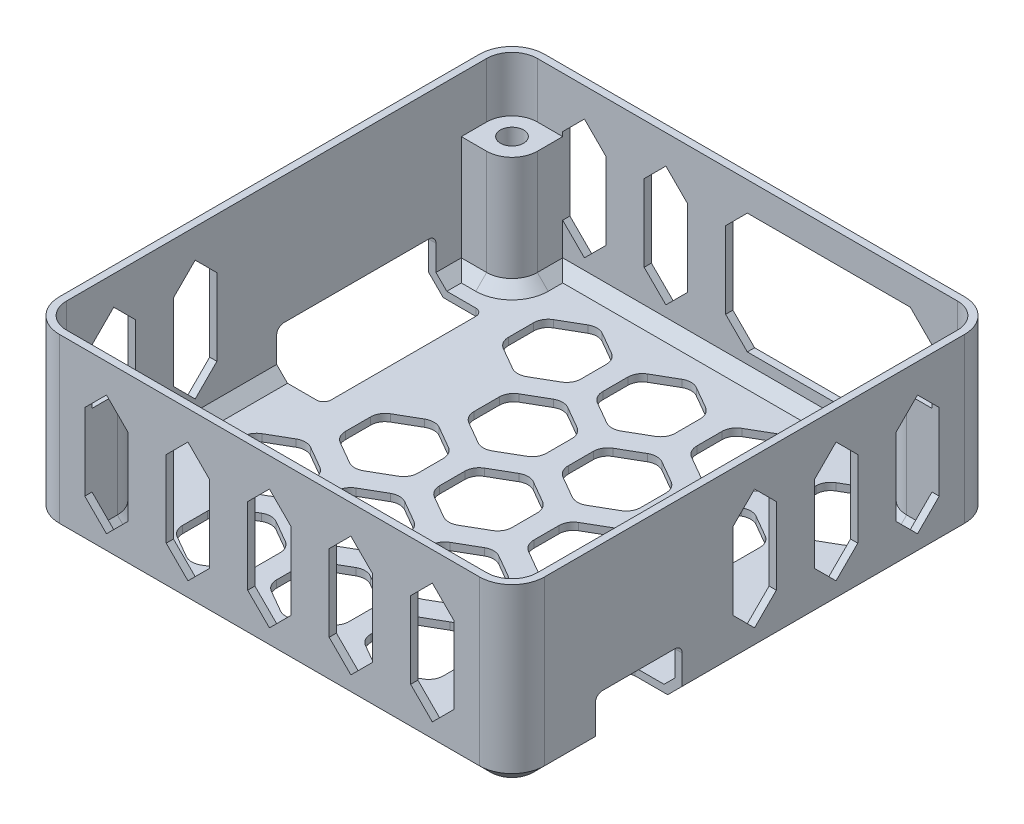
SolidWorks part; units mm, degrees
ref_plane "前视基准面" through (0, 0, 0) normal (0, 0, 1) x (1, 0, 0)
ref_plane "上视基准面" through (0, 0, 0) normal (0, 1, 0) x (1, 0, 0)
ref_plane "右视基准面" through (0, 0, 0) normal (1, 0, 0) x (0, 0, -1)
other "Configuration Table"
sketch "草图1" plane through (0, 0, 0) normal (0, 1, 0) x (1, 0, 0)
  line L0 (-29, 29) -> (29, 29) construction
  line L1 (-29, 33.5) -> (29, 33.5)
  line L2 (-33.5, 29) -> (-33.5, -29)
  line L3 (-29, -33.5) -> (29, -33.5)
  line L4 (33.5, 29) -> (33.5, -29)
  line L5 (-29, 29) -> (-29, -29) construction
  circle A0 centre (-29, 29) radius 1.6
  circle A1 centre (29, 29) radius 1.6
  circle A2 centre (29, -29) radius 1.6
  circle A3 centre (-29, -29) radius 1.6
  arc A4 (-33.5, -29) -> (-29, -33.5) centre (-29, -29) ccw
  arc A5 (29, -33.5) -> (33.5, -29) centre (29, -29) ccw
  arc A6 (29, 33.5) -> (33.5, 29) centre (29, 29) cw
  arc A7 (-29, 33.5) -> (-33.5, 29) centre (-29, 29) ccw
  dimension "D6" = 3.2
  dimension "D13" = 4.5
  dimension "D3" = 90
  dimension "D4" = 58
  dimension "D5" = 58
  dimension "D7" = 29
  dimension "D8" = 29
  dimension "D9" = 4.5
  dimension "D10" = 4.5
  dimension "D11" = 4.5
  dimension "D12" = 4.5
  dimension "D1" = 2
  dimension "D2" = 2
extrude "凸台-拉伸1" add sketch "草图1" along normal blind 1
sketch "草图2" plane through (0, 1, 0) normal (0, 1, 0) x (1, 0, 0)
  line L0 (29, 33.5) -> (-29, 33.5) construction
  line L1 (-33.5, 29) -> (-33.5, -29) construction
  line L2 (-29, -33.5) -> (29, -33.5) construction
  line L3 (33.5, -29) -> (33.5, 29) construction
  line L4 (29, 33.5) -> (-29, 33.5)
  line L5 (-33.5, 29) -> (-33.5, -29)
  line L6 (-29, -33.5) -> (29, -33.5)
  line L7 (33.5, -29) -> (33.5, 29)
  line L8 (-29, -32.5) -> (29, -32.5)
  line L9 (32.5, -29) -> (32.5, 29)
  line L10 (29, 32.5) -> (-29, 32.5)
  line L11 (-32.5, 29) -> (-32.5, -29)
  arc A0 (-33.5, -29) -> (-29, -33.5) centre (-29, -29) ccw construction
  arc A1 (29, -33.5) -> (33.5, -29) centre (29, -29) ccw construction
  arc A2 (33.5, 29) -> (29, 33.5) centre (29, 29) ccw construction
  arc A3 (-29, 33.5) -> (-33.5, 29) centre (-29, 29) ccw construction
  arc A4 (-33.5, -29) -> (-29, -33.5) centre (-29, -29) ccw
  arc A5 (29, -33.5) -> (33.5, -29) centre (29, -29) ccw
  arc A6 (33.5, 29) -> (29, 33.5) centre (29, 29) ccw
  arc A7 (-29, 33.5) -> (-33.5, 29) centre (-29, 29) ccw
  arc A8 (-32.5, -29) -> (-29, -32.5) centre (-29, -29) ccw
  arc A9 (29, -32.5) -> (32.5, -29) centre (29, -29) ccw
  arc A10 (32.5, 29) -> (29, 32.5) centre (29, 29) ccw
  arc A11 (-29, 32.5) -> (-32.5, 29) centre (-29, 29) ccw
  circle A12 centre (-29, -29) radius 1.6 construction
  circle A13 centre (29, -29) radius 1.6 construction
  circle A14 centre (29, 29) radius 1.6 construction
  circle A15 centre (-29, 29) radius 1.6 construction
  circle A16 centre (-29, -29) radius 1.6
  circle A17 centre (29, -29) radius 1.6
  circle A18 centre (29, 29) radius 1.6
  circle A19 centre (-29, 29) radius 1.6
  dimension "D1" = 1
extrude "凸台-拉伸2" add sketch "草图2" along normal blind 23.6 contours A11 L10 A10 L9 A9 L8 A8 L11 M26 M19 M20 M21 M22 M23 M24 M25
sketch "草图3" plane through (0, 1, 0) normal (0, 1, 0) x (1, 0, 0)
  line L0 (-29, 32.5) -> (-25.5, 32.5)
  line L1 (29, 32.5) -> (-29, 32.5) construction
  line L2 (-25.5, 32.5) -> (-25.5, 29)
  line L3 (-29, 25.5) -> (-32.5, 25.5)
  line L4 (-32.5, 29) -> (-32.5, -29) construction
  line L5 (-32.5, 25.5) -> (-32.5, 29)
  line L6 (32.5, 29) -> (32.5, 25.5)
  line L7 (32.5, 25.5) -> (29, 25.5)
  line L8 (25.5, 29) -> (25.5, 32.5)
  line L9 (25.5, 32.5) -> (29, 32.5)
  line L10 (29, -32.5) -> (25.5, -32.5)
  line L11 (25.5, -32.5) -> (25.5, -29)
  line L12 (29, -25.5) -> (32.5, -25.5)
  line L13 (32.5, -25.5) -> (32.5, -29)
  line L14 (-32.5, -29) -> (-32.5, -25.5)
  line L15 (-32.5, -25.5) -> (-29, -25.5)
  line L16 (-25.5, -29) -> (-25.5, -32.5)
  line L17 (-25.5, -32.5) -> (-29, -32.5)
  arc A3 (-29, 32.5) -> (-32.5, 29) centre (-29, 29) ccw construction
  circle A7 centre (-29, 29) radius 1.6 construction
  arc A8 (32.5, 29) -> (29, 32.5) centre (29, 29) ccw
  circle A9 centre (29, 29) radius 1.6
  arc A10 (25.5, 29) -> (29, 25.5) centre (29, 29) ccw
  arc A11 (-29, 32.5) -> (-32.5, 29) centre (-29, 29) ccw
  circle A15 centre (-29, 29) radius 1.6
  arc A16 (-29, 25.5) -> (-25.5, 29) centre (-29, 29) ccw
  arc A17 (29, -32.5) -> (32.5, -29) centre (29, -29) ccw
  circle A18 centre (29, -29) radius 1.6
  arc A19 (29, -25.5) -> (25.5, -29) centre (29, -29) ccw
  arc A20 (-32.5, -29) -> (-29, -32.5) centre (-29, -29) ccw
  circle A21 centre (-29, -29) radius 1.6
  arc A22 (-25.5, -29) -> (-29, -25.5) centre (-29, -29) ccw
  point P0 (-21.1789, -28.4706)
  point P40 (0, 0)
  dimension "D1" = 3.5
  dimension "D2" = 4
extrude "凸台-拉伸3" add sketch "草图3" along normal blind 16
sketch "草图5" plane through (0, 0, -33.5) normal (0, 0, 1) x (1, 0, 0)
  line L0 (-22.5, 20.6) -> (-25.5, 17.6)
  line L1 (-25.5, 17.6) -> (-25.5, 7)
  line L2 (-25.5, 7) -> (-22.5, 4)
  line L3 (-22.5, 4) -> (-19.5, 7)
  line L4 (-19.5, 7) -> (-19.5, 17.6)
  line L5 (-19.5, 17.6) -> (-22.5, 20.6)
  line L6 (-8.25, 17.6) -> (-11.25, 20.6)
  line L7 (-11.25, 20.6) -> (-14.25, 17.6)
  line L8 (-14.25, 17.6) -> (-14.25, 7)
  line L9 (-14.25, 7) -> (-11.25, 4)
  line L10 (-11.25, 4) -> (-8.25, 7)
  line L11 (-8.25, 7) -> (-8.25, 17.6)
  line L12 (3, 17.6) -> (0, 20.6)
  line L13 (0, 20.6) -> (-3, 17.6)
  line L14 (-3, 17.6) -> (-3, 7)
  line L15 (-3, 7) -> (0, 4)
  line L16 (0, 4) -> (3, 7)
  line L17 (3, 7) -> (3, 17.6)
  line L18 (14.25, 17.6) -> (11.25, 20.6)
  line L19 (11.25, 20.6) -> (8.25, 17.6)
  line L20 (8.25, 17.6) -> (8.25, 7)
  line L21 (8.25, 7) -> (11.25, 4)
  line L22 (11.25, 4) -> (14.25, 7)
  line L23 (14.25, 7) -> (14.25, 17.6)
  line L24 (25.5, 17.6) -> (22.5, 20.6)
  line L25 (22.5, 20.6) -> (19.5, 17.6)
  line L26 (19.5, 17.6) -> (19.5, 7)
  line L27 (19.5, 7) -> (22.5, 4)
  line L28 (22.5, 4) -> (25.5, 7)
  line L29 (25.5, 7) -> (25.5, 17.6)
  line L30 (-19.5, 17.6) -> (-8.25, 17.6) construction
  line L35 (-29, 24.6) -> (29, 24.6) construction
  line L36 (-29, 0) -> (29, 0) construction
  line L37 (-29, 24.6) -> (-29, 0) construction
  line L38 (29, 24.6) -> (29, 0) construction
  dimension "D1" = 6
  dimension "D2" = 4
  dimension "D4" = 4
  dimension "D5" = 3.5
  dimension "D6" = 3.5
  dimension "D3" = 5
extrude "切除-拉伸2" cut sketch "草图5" along normal through all
sketch "草图6" plane through (0, 0, 0) normal (0, -1, 0) x (1, 0, 0)
  line L1 (-33.5, 0) -> (-26, 0)
  line L2 (-33.5, 0) -> (-33.5, -22)
  line L3 (-33.5, -22) -> (-26, -22)
  line L4 (-26, 0) -> (-26, -22)
  line L5 (33.5, 22) -> (26, 22)
  line L6 (33.5, 22) -> (33.5, 10)
  line L7 (33.5, 10) -> (26, 10)
  line L8 (26, 22) -> (26, 10)
  line L10 (-33.5, -29) -> (-33.5, 29) construction
  line L11 (33.5, 29) -> (33.5, -29) construction
  circle A0 centre (-29, -29) radius 1.6 construction
  circle A1 centre (29, 29) radius 1.6 construction
  dimension "D3" = 7
  dimension "D1" = 7.5
  dimension "D2" = 7.5
  dimension "D4" = 29
  dimension "D5" = 7
  dimension "D6" = 19
extrude "切除-拉伸3" cut sketch "草图6" against normal blind 7
sketch "草图7" plane through (0, 0, -33.5) normal (0, 0, -1) x (-1, 0, 0)
  line L5 (0, 4) -> (-22.5, 4)
  line L6 (0, 4) -> (0, 20.6)
  line L7 (0, 20.6) -> (-22.5, 20.6)
  line L8 (-22.5, 4) -> (-22.5, 20.6)
extrude "切除-拉伸5" cut sketch "草图7" against normal blind 1
sketch "草图4" plane through (-33.5, 0, 0) normal (-1, 0, 0) x (0, 0, 1)
  line L18 (14.25, 17.6) -> (11.25, 20.6)
  line L19 (11.25, 20.6) -> (8.25, 17.6)
  line L20 (8.25, 17.6) -> (8.25, 7)
  line L21 (8.25, 7) -> (11.25, 4)
  line L22 (11.25, 4) -> (14.25, 7)
  line L23 (14.25, 7) -> (14.25, 17.6)
  line L24 (25.5, 17.6) -> (22.5, 20.6)
  line L25 (22.5, 20.6) -> (19.5, 17.6)
  line L26 (19.5, 17.6) -> (19.5, 7)
  line L27 (19.5, 7) -> (22.5, 4)
  line L28 (22.5, 4) -> (25.5, 7)
  line L29 (25.5, 7) -> (25.5, 17.6)
extrude "切除-拉伸6" cut sketch "草图4" against normal blind 1
sketch "草图8" plane through (33.5, 0, -33.5) normal (-1, 0, 0) x (0, 0, 1)
  line L0 (11, 20.6) -> (8, 17.6)
  line L1 (8, 17.6) -> (8, 7)
  line L2 (8, 7) -> (11, 4)
  line L3 (11, 4) -> (14, 7)
  line L4 (14, 7) -> (14, 17.6)
  line L5 (14, 17.6) -> (11, 20.6)
  line L6 (25.25, 17.6) -> (22.25, 20.6)
  line L7 (22.25, 20.6) -> (19.25, 17.6)
  line L8 (19.25, 17.6) -> (19.25, 7)
  line L9 (19.25, 7) -> (22.25, 4)
  line L10 (22.25, 4) -> (25.25, 7)
  line L11 (25.25, 7) -> (25.25, 17.6)
  line L12 (36.5, 17.6) -> (33.5, 20.6)
  line L13 (33.5, 20.6) -> (30.5, 17.6)
  line L14 (30.5, 17.6) -> (30.5, 7)
  line L15 (30.5, 7) -> (33.5, 4)
  line L16 (33.5, 4) -> (36.5, 7)
  line L17 (36.5, 7) -> (36.5, 17.6)
  line L30 (14, 17.6) -> (25.25, 17.6) construction
  line L31 (4.5, 24.6) -> (4.5, 0) construction
  line L32 (43.5, 0) -> (4.5, 0) construction
  line L33 (62.5, 24.6) -> (4.5, 24.6) construction
  line L34 (47.75, 17.6) -> (44.75, 20.6)
  line L35 (44.75, 20.6) -> (41.75, 17.6)
  line L36 (41.75, 17.6) -> (41.75, 7)
  line L37 (41.75, 7) -> (44.75, 4)
  line L38 (44.75, 4) -> (47.75, 7)
  line L39 (47.75, 7) -> (47.75, 17.6)
  line L40 (59, 17.6) -> (56, 20.6)
  line L41 (56, 20.6) -> (53, 17.6)
  line L42 (53, 17.6) -> (53, 7)
  line L43 (53, 7) -> (56, 4)
  line L44 (56, 4) -> (59, 7)
  line L45 (59, 7) -> (59, 17.6)
  point P5 (0, 0)
  point P8 (0, 0)
  point P34 (0, 0)
  dimension "D1" = 6
  dimension "D2" = 3.5
  dimension "D4" = 4
  dimension "D5" = 4
  dimension "D3" = 5
extrude "切除-拉伸7" cut sketch "草图8" along normal blind 1
chamfer "倒角1" distance 1.5 18 edges at (-32.5, 1, 12.75) (-25.5, 1, 30.75) (-30.75, 1, 25.5) (-26.5251, 1, 26.5251) (0, 1, 32.5) (32.5, 1, 23.75) (30.75, 1, 25.5) (25.5, 1, 30.75) (26.5251, 1, 26.5251) (32.5, 1, -7.75) (25.5, 1, -30.75) (30.75, 1, -25.5) (26.5251, 1, -26.5251) (-25.5, 1, -30.75) (-26.5251, 1, -26.5251) (-30.75, 1, -25.5) (-32.5, 1, -23.75) (0, 1, -32.5)
chamfer "倒角2" distance 2 10 edges at (-33.5, 0, 14.5) (-32.182, 0, 32.182) (0, 0, 33.5) (32.182, 0, 32.182) (33.5, 0, 25.5) (33.5, 0, -9.5) (-33.5, 0, -25.5) (32.182, 0, -32.182) (-32.182, 0, -32.182) (0, 0, -33.5)
sketch "草图10" plane through (0, 0, 0) normal (0, -1, 0) x (1, 0, 0)
  line L0 (-29, 29) -> (29, 29) construction
  line L1 (-29, 29) -> (-29, -29) construction
  circle A0 centre (-29, 29) radius 2.9
  circle A1 centre (29, 29) radius 2.9
  circle A2 centre (29, -29) radius 2.9
  circle A3 centre (-29, -29) radius 2.9
  point P3 (29, -29)
  dimension "D4" = 5.8
  dimension "D3" = 90
  dimension "D1" = 2
  dimension "D2" = 2
extrude "切除-拉伸9" cut sketch "草图10" against normal blind 2
fillet "圆角2" radius 1 8 edges at (-33, 7, -22) (-33, 7, 0) (33, 7, 22) (33, 7, 10) (26, 0.5, 10) (26, 0.5, 22) (-26, 0.5, -22) (-26, 0.5, 0)
sketch "草图12" plane through (0, 0, 0) normal (0, -1, 0) x (1, 0, 0)
  line L0 (-55.25, 28.2902) -> (-50.25, 19.6299) construction
  line L1 (-55.25, 28.2902) -> (-60.25, 25.4034)
  line L2 (-60.25, 25.4034) -> (-60.25, 19.6299)
  line L3 (-60.25, 19.6299) -> (-55.25, 16.7432)
  line L4 (-55.25, 16.7432) -> (-50.25, 19.6299)
  line L5 (-50.25, 19.6299) -> (-50.25, 25.4034)
  line L6 (-50.25, 25.4034) -> (-55.25, 28.2902)
  line L7 (-42.25, 28.2902) -> (-47.25, 25.4034)
  line L8 (-47.25, 25.4034) -> (-47.25, 19.6299)
  line L9 (-47.25, 19.6299) -> (-42.25, 16.7432)
  line L10 (-42.25, 16.7432) -> (-37.25, 19.6299)
  line L11 (-37.25, 19.6299) -> (-37.25, 25.4034)
  line L12 (-37.25, 25.4034) -> (-42.25, 28.2902)
  line L13 (-29.25, 28.2902) -> (-34.25, 25.4034)
  line L14 (-34.25, 25.4034) -> (-34.25, 19.6299)
  line L15 (-34.25, 19.6299) -> (-29.25, 16.7432)
  line L16 (-29.25, 16.7432) -> (-24.25, 19.6299)
  line L17 (-24.25, 19.6299) -> (-24.25, 25.4034)
  line L18 (-24.25, 25.4034) -> (-29.25, 28.2902)
  line L19 (-16.25, 28.2902) -> (-21.25, 25.4034)
  line L20 (-21.25, 25.4034) -> (-21.25, 19.6299)
  line L21 (-21.25, 19.6299) -> (-16.25, 16.7432)
  line L22 (-16.25, 16.7432) -> (-11.25, 19.6299)
  line L23 (-11.25, 19.6299) -> (-11.25, 25.4034)
  line L24 (-11.25, 25.4034) -> (-16.25, 28.2902)
  line L25 (-3.25, 28.2902) -> (-8.25, 25.4034)
  line L26 (-8.25, 25.4034) -> (-8.25, 19.6299)
  line L27 (-8.25, 19.6299) -> (-3.25, 16.7432)
  line L28 (-3.25, 16.7432) -> (1.75, 19.6299)
  line L29 (1.75, 19.6299) -> (1.75, 25.4034)
  line L30 (1.75, 25.4034) -> (-3.25, 28.2902)
  line L31 (9.75, 28.2902) -> (4.75, 25.4034)
  line L32 (4.75, 25.4034) -> (4.75, 19.6299)
  line L33 (4.75, 19.6299) -> (9.75, 16.7432)
  line L34 (9.75, 16.7432) -> (14.75, 19.6299)
  line L35 (14.75, 19.6299) -> (14.75, 25.4034)
  line L36 (14.75, 25.4034) -> (9.75, 28.2902)
  line L37 (22.75, 28.2902) -> (17.75, 25.4034)
  line L38 (17.75, 25.4034) -> (17.75, 19.6299)
  line L39 (17.75, 19.6299) -> (22.75, 16.7432)
  line L40 (22.75, 16.7432) -> (27.75, 19.6299)
  line L41 (27.75, 19.6299) -> (27.75, 25.4034)
  line L42 (27.75, 25.4034) -> (22.75, 28.2902)
  line L43 (35.75, 28.2902) -> (30.75, 25.4034)
  line L44 (30.75, 25.4034) -> (30.75, 19.6299)
  line L45 (30.75, 19.6299) -> (35.75, 16.7432)
  line L46 (35.75, 16.7432) -> (40.75, 19.6299)
  line L47 (40.75, 19.6299) -> (40.75, 25.4034)
  line L48 (40.75, 25.4034) -> (35.75, 28.2902)
  line L49 (48.75, 28.2902) -> (43.75, 25.4034)
  line L50 (43.75, 25.4034) -> (43.75, 19.6299)
  line L51 (43.75, 19.6299) -> (48.75, 16.7432)
  line L52 (48.75, 16.7432) -> (53.75, 19.6299)
  line L53 (53.75, 19.6299) -> (53.75, 25.4034)
  line L54 (53.75, 25.4034) -> (48.75, 28.2902)
  line L55 (-35.75, 17.0318) -> (-40.75, 14.1451)
  line L56 (-40.75, 14.1451) -> (-40.75, 8.3716)
  line L57 (-40.75, 8.3716) -> (-35.75, 5.4848)
  line L58 (-35.75, 5.4848) -> (-30.75, 8.3716)
  line L59 (-30.75, 8.3716) -> (-30.75, 14.1451)
  line L60 (-30.75, 14.1451) -> (-35.75, 17.0318)
  line L61 (-22.75, 17.0318) -> (-27.75, 14.1451)
  line L62 (-27.75, 14.1451) -> (-27.75, 8.3716)
  line L63 (-27.75, 8.3716) -> (-22.75, 5.4848)
  line L64 (-22.75, 5.4848) -> (-17.75, 8.3716)
  line L65 (-17.75, 8.3716) -> (-17.75, 14.1451)
  line L66 (-17.75, 14.1451) -> (-22.75, 17.0318)
  line L67 (-9.75, 17.0318) -> (-14.75, 14.1451)
  line L68 (-14.75, 14.1451) -> (-14.75, 8.3716)
  line L69 (-14.75, 8.3716) -> (-9.75, 5.4848)
  line L70 (-9.75, 5.4848) -> (-4.75, 8.3716)
  line L71 (-4.75, 8.3716) -> (-4.75, 14.1451)
  line L72 (-4.75, 14.1451) -> (-9.75, 17.0318)
  line L73 (3.25, 17.0318) -> (-1.75, 14.1451)
  line L74 (-1.75, 14.1451) -> (-1.75, 8.3716)
  line L75 (-1.75, 8.3716) -> (3.25, 5.4848)
  line L76 (3.25, 5.4848) -> (8.25, 8.3716)
  line L77 (8.25, 8.3716) -> (8.25, 14.1451)
  line L78 (8.25, 14.1451) -> (3.25, 17.0318)
  line L79 (16.25, 17.0318) -> (11.25, 14.1451)
  line L80 (11.25, 14.1451) -> (11.25, 8.3716)
  line L81 (11.25, 8.3716) -> (16.25, 5.4848)
  line L82 (16.25, 5.4848) -> (21.25, 8.3716)
  line L83 (21.25, 8.3716) -> (21.25, 14.1451)
  line L84 (21.25, 14.1451) -> (16.25, 17.0318)
  line L85 (29.25, 17.0318) -> (24.25, 14.1451)
  line L86 (24.25, 14.1451) -> (24.25, 8.3716)
  line L87 (24.25, 8.3716) -> (29.25, 5.4848)
  line L88 (29.25, 5.4848) -> (34.25, 8.3716)
  line L89 (34.25, 8.3716) -> (34.25, 14.1451)
  line L90 (34.25, 14.1451) -> (29.25, 17.0318)
  line L91 (42.25, 17.0318) -> (37.25, 14.1451)
  line L92 (37.25, 14.1451) -> (37.25, 8.3716)
  line L93 (37.25, 8.3716) -> (42.25, 5.4848)
  line L94 (42.25, 5.4848) -> (47.25, 8.3716)
  line L95 (47.25, 8.3716) -> (47.25, 14.1451)
  line L96 (47.25, 14.1451) -> (42.25, 17.0318)
  line L97 (55.25, 17.0318) -> (50.25, 14.1451)
  line L98 (50.25, 14.1451) -> (50.25, 8.3716)
  line L99 (50.25, 8.3716) -> (55.25, 5.4848)
  line L100 (55.25, 5.4848) -> (60.25, 8.3716)
  line L101 (60.25, 8.3716) -> (60.25, 14.1451)
  line L102 (60.25, 14.1451) -> (55.25, 17.0318)
  line L103 (-29.25, 5.7735) -> (-34.25, 2.8868)
  line L104 (-34.25, 2.8868) -> (-34.25, -2.8868)
  line L105 (-34.25, -2.8868) -> (-29.25, -5.7735)
  line L106 (-29.25, -5.7735) -> (-24.25, -2.8868)
  line L107 (-24.25, -2.8868) -> (-24.25, 2.8868)
  line L108 (-24.25, 2.8868) -> (-29.25, 5.7735)
  line L109 (-16.25, 5.7735) -> (-21.25, 2.8868)
  line L110 (-21.25, 2.8868) -> (-21.25, -2.8868)
  line L111 (-21.25, -2.8868) -> (-16.25, -5.7735)
  line L112 (-16.25, -5.7735) -> (-11.25, -2.8868)
  line L113 (-11.25, -2.8868) -> (-11.25, 2.8868)
  line L114 (-11.25, 2.8868) -> (-16.25, 5.7735)
  line L115 (-3.25, 5.7735) -> (-8.25, 2.8868)
  line L116 (-8.25, 2.8868) -> (-8.25, -2.8868)
  line L117 (-8.25, -2.8868) -> (-3.25, -5.7735)
  line L118 (-3.25, -5.7735) -> (1.75, -2.8868)
  line L119 (1.75, -2.8868) -> (1.75, 2.8868)
  line L120 (1.75, 2.8868) -> (-3.25, 5.7735)
  line L121 (9.75, 5.7735) -> (4.75, 2.8868)
  line L122 (4.75, 2.8868) -> (4.75, -2.8868)
  line L123 (4.75, -2.8868) -> (9.75, -5.7735)
  line L124 (9.75, -5.7735) -> (14.75, -2.8868)
  line L125 (14.75, -2.8868) -> (14.75, 2.8868)
  line L126 (14.75, 2.8868) -> (9.75, 5.7735)
  line L127 (22.75, 5.7735) -> (17.75, 2.8868)
  line L128 (17.75, 2.8868) -> (17.75, -2.8868)
  line L129 (17.75, -2.8868) -> (22.75, -5.7735)
  line L130 (22.75, -5.7735) -> (27.75, -2.8868)
  line L131 (27.75, -2.8868) -> (27.75, 2.8868)
  line L132 (27.75, 2.8868) -> (22.75, 5.7735)
  line L133 (35.75, 5.7735) -> (30.75, 2.8868)
  line L134 (30.75, 2.8868) -> (30.75, -2.8868)
  line L135 (30.75, -2.8868) -> (35.75, -5.7735)
  line L136 (35.75, -5.7735) -> (40.75, -2.8868)
  line L137 (40.75, -2.8868) -> (40.75, 2.8868)
  line L138 (40.75, 2.8868) -> (35.75, 5.7735)
  line L139 (48.75, 5.7735) -> (43.75, 2.8868)
  line L140 (43.75, 2.8868) -> (43.75, -2.8868)
  line L141 (43.75, -2.8868) -> (48.75, -5.7735)
  line L142 (48.75, -5.7735) -> (53.75, -2.8868)
  line L143 (53.75, -2.8868) -> (53.75, 2.8868)
  line L144 (53.75, 2.8868) -> (48.75, 5.7735)
  line L145 (61.75, 5.7735) -> (56.75, 2.8868)
  line L146 (56.75, 2.8868) -> (56.75, -2.8868)
  line L147 (56.75, -2.8868) -> (61.75, -5.7735)
  line L148 (61.75, -5.7735) -> (66.75, -2.8868)
  line L149 (66.75, -2.8868) -> (66.75, 2.8868)
  line L150 (66.75, 2.8868) -> (61.75, 5.7735)
  line L151 (-22.75, -5.4848) -> (-27.75, -8.3716)
  line L152 (-27.75, -8.3716) -> (-27.75, -14.1451)
  line L153 (-27.75, -14.1451) -> (-22.75, -17.0318)
  line L154 (-22.75, -17.0318) -> (-17.75, -14.1451)
  line L155 (-17.75, -14.1451) -> (-17.75, -8.3716)
  line L156 (-17.75, -8.3716) -> (-22.75, -5.4848)
  line L157 (-9.75, -5.4848) -> (-14.75, -8.3716)
  line L158 (-14.75, -8.3716) -> (-14.75, -14.1451)
  line L159 (-14.75, -14.1451) -> (-9.75, -17.0318)
  line L160 (-9.75, -17.0318) -> (-4.75, -14.1451)
  line L161 (-4.75, -14.1451) -> (-4.75, -8.3716)
  line L162 (-4.75, -8.3716) -> (-9.75, -5.4848)
  line L163 (3.25, -5.4848) -> (-1.75, -8.3716)
  line L164 (-1.75, -8.3716) -> (-1.75, -14.1451)
  line L165 (-1.75, -14.1451) -> (3.25, -17.0318)
  line L166 (3.25, -17.0318) -> (8.25, -14.1451)
  line L167 (8.25, -14.1451) -> (8.25, -8.3716)
  line L168 (8.25, -8.3716) -> (3.25, -5.4848)
  line L169 (16.25, -5.4848) -> (11.25, -8.3716)
  line L170 (11.25, -8.3716) -> (11.25, -14.1451)
  line L171 (11.25, -14.1451) -> (16.25, -17.0318)
  line L172 (16.25, -17.0318) -> (21.25, -14.1451)
  line L173 (21.25, -14.1451) -> (21.25, -8.3716)
  line L174 (21.25, -8.3716) -> (16.25, -5.4848)
  line L175 (29.25, -5.4848) -> (24.25, -8.3716)
  line L176 (24.25, -8.3716) -> (24.25, -14.1451)
  line L177 (24.25, -14.1451) -> (29.25, -17.0318)
  line L178 (29.25, -17.0318) -> (34.25, -14.1451)
  line L179 (34.25, -14.1451) -> (34.25, -8.3716)
  line L180 (34.25, -8.3716) -> (29.25, -5.4848)
  line L181 (42.25, -5.4848) -> (37.25, -8.3716)
  line L182 (37.25, -8.3716) -> (37.25, -14.1451)
  line L183 (37.25, -14.1451) -> (42.25, -17.0318)
  line L184 (42.25, -17.0318) -> (47.25, -14.1451)
  line L185 (47.25, -14.1451) -> (47.25, -8.3716)
  line L186 (47.25, -8.3716) -> (42.25, -5.4848)
  line L187 (55.25, -5.4848) -> (50.25, -8.3716)
  line L188 (50.25, -8.3716) -> (50.25, -14.1451)
  line L189 (50.25, -14.1451) -> (55.25, -17.0318)
  line L190 (55.25, -17.0318) -> (60.25, -14.1451)
  line L191 (60.25, -14.1451) -> (60.25, -8.3716)
  line L192 (60.25, -8.3716) -> (55.25, -5.4848)
  line L193 (68.25, -5.4848) -> (63.25, -8.3716)
  line L194 (63.25, -8.3716) -> (63.25, -14.1451)
  line L195 (63.25, -14.1451) -> (68.25, -17.0318)
  line L196 (68.25, -17.0318) -> (73.25, -14.1451)
  line L197 (73.25, -14.1451) -> (73.25, -8.3716)
  line L198 (73.25, -8.3716) -> (68.25, -5.4848)
  line L199 (-16.25, -16.7432) -> (-21.25, -19.6299)
  line L200 (-21.25, -19.6299) -> (-21.25, -25.4034)
  line L201 (-21.25, -25.4034) -> (-16.25, -28.2902)
  line L202 (-16.25, -28.2902) -> (-11.25, -25.4034)
  line L203 (-11.25, -25.4034) -> (-11.25, -19.6299)
  line L204 (-11.25, -19.6299) -> (-16.25, -16.7432)
  line L205 (-3.25, -16.7432) -> (-8.25, -19.6299)
  line L206 (-8.25, -19.6299) -> (-8.25, -25.4034)
  line L207 (-8.25, -25.4034) -> (-3.25, -28.2902)
  line L208 (-3.25, -28.2902) -> (1.75, -25.4034)
  line L209 (1.75, -25.4034) -> (1.75, -19.6299)
  line L210 (1.75, -19.6299) -> (-3.25, -16.7432)
  line L211 (9.75, -16.7432) -> (4.75, -19.6299)
  line L212 (4.75, -19.6299) -> (4.75, -25.4034)
  line L213 (4.75, -25.4034) -> (9.75, -28.2902)
  line L214 (9.75, -28.2902) -> (14.75, -25.4034)
  line L215 (14.75, -25.4034) -> (14.75, -19.6299)
  line L216 (14.75, -19.6299) -> (9.75, -16.7432)
  line L217 (22.75, -16.7432) -> (17.75, -19.6299)
  line L218 (17.75, -19.6299) -> (17.75, -25.4034)
  line L219 (17.75, -25.4034) -> (22.75, -28.2902)
  line L220 (22.75, -28.2902) -> (27.75, -25.4034)
  line L221 (27.75, -25.4034) -> (27.75, -19.6299)
  line L222 (27.75, -19.6299) -> (22.75, -16.7432)
  line L223 (35.75, -16.7432) -> (30.75, -19.6299)
  line L224 (30.75, -19.6299) -> (30.75, -25.4034)
  line L225 (30.75, -25.4034) -> (35.75, -28.2902)
  line L226 (35.75, -28.2902) -> (40.75, -25.4034)
  line L227 (40.75, -25.4034) -> (40.75, -19.6299)
  line L228 (40.75, -19.6299) -> (35.75, -16.7432)
  line L229 (48.75, -16.7432) -> (43.75, -19.6299)
  line L230 (43.75, -19.6299) -> (43.75, -25.4034)
  line L231 (43.75, -25.4034) -> (48.75, -28.2902)
  line L232 (48.75, -28.2902) -> (53.75, -25.4034)
  line L233 (53.75, -25.4034) -> (53.75, -19.6299)
  line L234 (53.75, -19.6299) -> (48.75, -16.7432)
  line L235 (61.75, -16.7432) -> (56.75, -19.6299)
  line L236 (56.75, -19.6299) -> (56.75, -25.4034)
  line L237 (56.75, -25.4034) -> (61.75, -28.2902)
  line L238 (61.75, -28.2902) -> (66.75, -25.4034)
  line L239 (66.75, -25.4034) -> (66.75, -19.6299)
  line L240 (66.75, -19.6299) -> (61.75, -16.7432)
  line L241 (74.75, -16.7432) -> (69.75, -19.6299)
  line L242 (69.75, -19.6299) -> (69.75, -25.4034)
  line L243 (69.75, -25.4034) -> (74.75, -28.2902)
  line L244 (74.75, -28.2902) -> (79.75, -25.4034)
  line L245 (79.75, -25.4034) -> (79.75, -19.6299)
  line L246 (79.75, -19.6299) -> (74.75, -16.7432)
  line L247 (-9.75, -28.0015) -> (-14.75, -30.8882)
  line L248 (-14.75, -30.8882) -> (-14.75, -36.6617)
  line L249 (-14.75, -36.6617) -> (-9.75, -39.5485)
  line L250 (-9.75, -39.5485) -> (-4.75, -36.6617)
  line L251 (-4.75, -36.6617) -> (-4.75, -30.8882)
  line L252 (-4.75, -30.8882) -> (-9.75, -28.0015)
  line L253 (3.25, -28.0015) -> (-1.75, -30.8882)
  line L254 (-1.75, -30.8882) -> (-1.75, -36.6617)
  line L255 (-1.75, -36.6617) -> (3.25, -39.5485)
  line L256 (3.25, -39.5485) -> (8.25, -36.6617)
  line L257 (8.25, -36.6617) -> (8.25, -30.8882)
  line L258 (8.25, -30.8882) -> (3.25, -28.0015)
  line L259 (16.25, -28.0015) -> (11.25, -30.8882)
  line L260 (11.25, -30.8882) -> (11.25, -36.6617)
  line L261 (11.25, -36.6617) -> (16.25, -39.5485)
  line L262 (16.25, -39.5485) -> (21.25, -36.6617)
  line L263 (21.25, -36.6617) -> (21.25, -30.8882)
  line L264 (21.25, -30.8882) -> (16.25, -28.0015)
  line L265 (29.25, -28.0015) -> (24.25, -30.8882)
  line L266 (24.25, -30.8882) -> (24.25, -36.6617)
  line L267 (24.25, -36.6617) -> (29.25, -39.5485)
  line L268 (29.25, -39.5485) -> (34.25, -36.6617)
  line L269 (34.25, -36.6617) -> (34.25, -30.8882)
  line L270 (34.25, -30.8882) -> (29.25, -28.0015)
  line L271 (42.25, -28.0015) -> (37.25, -30.8882)
  line L272 (37.25, -30.8882) -> (37.25, -36.6617)
  line L273 (37.25, -36.6617) -> (42.25, -39.5485)
  line L274 (42.25, -39.5485) -> (47.25, -36.6617)
  line L275 (47.25, -36.6617) -> (47.25, -30.8882)
  line L276 (47.25, -30.8882) -> (42.25, -28.0015)
  line L277 (55.25, -28.0015) -> (50.25, -30.8882)
  line L278 (50.25, -30.8882) -> (50.25, -36.6617)
  line L279 (50.25, -36.6617) -> (55.25, -39.5485)
  line L280 (55.25, -39.5485) -> (60.25, -36.6617)
  line L281 (60.25, -36.6617) -> (60.25, -30.8882)
  line L282 (60.25, -30.8882) -> (55.25, -28.0015)
  line L283 (68.25, -28.0015) -> (63.25, -30.8882)
  line L284 (63.25, -30.8882) -> (63.25, -36.6617)
  line L285 (63.25, -36.6617) -> (68.25, -39.5485)
  line L286 (68.25, -39.5485) -> (73.25, -36.6617)
  line L287 (73.25, -36.6617) -> (73.25, -30.8882)
  line L288 (73.25, -30.8882) -> (68.25, -28.0015)
  line L289 (81.25, -28.0015) -> (76.25, -30.8882)
  line L290 (76.25, -30.8882) -> (76.25, -36.6617)
  line L291 (76.25, -36.6617) -> (81.25, -39.5485)
  line L292 (81.25, -39.5485) -> (86.25, -36.6617)
  line L293 (86.25, -36.6617) -> (86.25, -30.8882)
  line L294 (86.25, -30.8882) -> (81.25, -28.0015)
  line L295 (-3.25, -39.2598) -> (-8.25, -42.1466)
  line L296 (-8.25, -42.1466) -> (-8.25, -47.9201)
  line L297 (-8.25, -47.9201) -> (-3.25, -50.8068)
  line L298 (-3.25, -50.8068) -> (1.75, -47.9201)
  line L299 (1.75, -47.9201) -> (1.75, -42.1466)
  line L300 (1.75, -42.1466) -> (-3.25, -39.2598)
  line L301 (9.75, -39.2598) -> (4.75, -42.1466)
  line L302 (4.75, -42.1466) -> (4.75, -47.9201)
  line L303 (4.75, -47.9201) -> (9.75, -50.8068)
  line L304 (9.75, -50.8068) -> (14.75, -47.9201)
  line L305 (14.75, -47.9201) -> (14.75, -42.1466)
  line L306 (14.75, -42.1466) -> (9.75, -39.2598)
  line L307 (22.75, -39.2598) -> (17.75, -42.1466)
  line L308 (17.75, -42.1466) -> (17.75, -47.9201)
  line L309 (17.75, -47.9201) -> (22.75, -50.8068)
  line L310 (22.75, -50.8068) -> (27.75, -47.9201)
  line L311 (27.75, -47.9201) -> (27.75, -42.1466)
  line L312 (27.75, -42.1466) -> (22.75, -39.2598)
  line L313 (35.75, -39.2598) -> (30.75, -42.1466)
  line L314 (30.75, -42.1466) -> (30.75, -47.9201)
  line L315 (30.75, -47.9201) -> (35.75, -50.8068)
  line L316 (35.75, -50.8068) -> (40.75, -47.9201)
  line L317 (40.75, -47.9201) -> (40.75, -42.1466)
  line L318 (40.75, -42.1466) -> (35.75, -39.2598)
  line L319 (48.75, -39.2598) -> (43.75, -42.1466)
  line L320 (43.75, -42.1466) -> (43.75, -47.9201)
  line L321 (43.75, -47.9201) -> (48.75, -50.8068)
  line L322 (48.75, -50.8068) -> (53.75, -47.9201)
  line L323 (53.75, -47.9201) -> (53.75, -42.1466)
  line L324 (53.75, -42.1466) -> (48.75, -39.2598)
  line L325 (61.75, -39.2598) -> (56.75, -42.1466)
  line L326 (56.75, -42.1466) -> (56.75, -47.9201)
  line L327 (56.75, -47.9201) -> (61.75, -50.8068)
  line L328 (61.75, -50.8068) -> (66.75, -47.9201)
  line L329 (66.75, -47.9201) -> (66.75, -42.1466)
  line L330 (66.75, -42.1466) -> (61.75, -39.2598)
  line L331 (74.75, -39.2598) -> (69.75, -42.1466)
  line L332 (69.75, -42.1466) -> (69.75, -47.9201)
  line L333 (69.75, -47.9201) -> (74.75, -50.8068)
  line L334 (74.75, -50.8068) -> (79.75, -47.9201)
  line L335 (79.75, -47.9201) -> (79.75, -42.1466)
  line L336 (79.75, -42.1466) -> (74.75, -39.2598)
  line L337 (87.75, -39.2598) -> (82.75, -42.1466)
  line L338 (82.75, -42.1466) -> (82.75, -47.9201)
  line L339 (82.75, -47.9201) -> (87.75, -50.8068)
  line L340 (87.75, -50.8068) -> (92.75, -47.9201)
  line L341 (92.75, -47.9201) -> (92.75, -42.1466)
  line L342 (92.75, -42.1466) -> (87.75, -39.2598)
  line L343 (3.25, -50.5181) -> (-1.75, -53.4049)
  line L344 (-1.75, -53.4049) -> (-1.75, -59.1784)
  line L345 (-1.75, -59.1784) -> (3.25, -62.0652)
  line L346 (3.25, -62.0652) -> (8.25, -59.1784)
  line L347 (8.25, -59.1784) -> (8.25, -53.4049)
  line L348 (8.25, -53.4049) -> (3.25, -50.5181)
  line L349 (16.25, -50.5181) -> (11.25, -53.4049)
  line L350 (11.25, -53.4049) -> (11.25, -59.1784)
  line L351 (11.25, -59.1784) -> (16.25, -62.0652)
  line L352 (16.25, -62.0652) -> (21.25, -59.1784)
  line L353 (21.25, -59.1784) -> (21.25, -53.4049)
  line L354 (21.25, -53.4049) -> (16.25, -50.5181)
  line L355 (29.25, -50.5181) -> (24.25, -53.4049)
  line L356 (24.25, -53.4049) -> (24.25, -59.1784)
  line L357 (24.25, -59.1784) -> (29.25, -62.0652)
  line L358 (29.25, -62.0652) -> (34.25, -59.1784)
  line L359 (34.25, -59.1784) -> (34.25, -53.4049)
  line L360 (34.25, -53.4049) -> (29.25, -50.5181)
  line L361 (42.25, -50.5181) -> (37.25, -53.4049)
  line L362 (37.25, -53.4049) -> (37.25, -59.1784)
  line L363 (37.25, -59.1784) -> (42.25, -62.0652)
  line L364 (42.25, -62.0652) -> (47.25, -59.1784)
  line L365 (47.25, -59.1784) -> (47.25, -53.4049)
  line L366 (47.25, -53.4049) -> (42.25, -50.5181)
  line L367 (55.25, -50.5181) -> (50.25, -53.4049)
  line L368 (50.25, -53.4049) -> (50.25, -59.1784)
  line L369 (50.25, -59.1784) -> (55.25, -62.0652)
  line L370 (55.25, -62.0652) -> (60.25, -59.1784)
  line L371 (60.25, -59.1784) -> (60.25, -53.4049)
  line L372 (60.25, -53.4049) -> (55.25, -50.5181)
  line L373 (68.25, -50.5181) -> (63.25, -53.4049)
  line L374 (63.25, -53.4049) -> (63.25, -59.1784)
  line L375 (63.25, -59.1784) -> (68.25, -62.0652)
  line L376 (68.25, -62.0652) -> (73.25, -59.1784)
  line L377 (73.25, -59.1784) -> (73.25, -53.4049)
  line L378 (73.25, -53.4049) -> (68.25, -50.5181)
  line L379 (81.25, -50.5181) -> (76.25, -53.4049)
  line L380 (76.25, -53.4049) -> (76.25, -59.1784)
  line L381 (76.25, -59.1784) -> (81.25, -62.0652)
  line L382 (81.25, -62.0652) -> (86.25, -59.1784)
  line L383 (86.25, -59.1784) -> (86.25, -53.4049)
  line L384 (86.25, -53.4049) -> (81.25, -50.5181)
  line L385 (94.25, -50.5181) -> (89.25, -53.4049)
  line L386 (89.25, -53.4049) -> (89.25, -59.1784)
  line L387 (89.25, -59.1784) -> (94.25, -62.0652)
  line L388 (94.25, -62.0652) -> (99.25, -59.1784)
  line L389 (99.25, -59.1784) -> (99.25, -53.4049)
  line L390 (99.25, -53.4049) -> (94.25, -50.5181)
  line L391 (9.75, -61.7765) -> (4.75, -64.6632)
  line L392 (4.75, -64.6632) -> (4.75, -70.4367)
  line L393 (4.75, -70.4367) -> (9.75, -73.3235)
  line L394 (9.75, -73.3235) -> (14.75, -70.4367)
  line L395 (14.75, -70.4367) -> (14.75, -64.6632)
  line L396 (14.75, -64.6632) -> (9.75, -61.7765)
  line L397 (22.75, -61.7765) -> (17.75, -64.6632)
  line L398 (17.75, -64.6632) -> (17.75, -70.4367)
  line L399 (17.75, -70.4367) -> (22.75, -73.3235)
  line L400 (22.75, -73.3235) -> (27.75, -70.4367)
  line L401 (27.75, -70.4367) -> (27.75, -64.6632)
  line L402 (27.75, -64.6632) -> (22.75, -61.7765)
  line L403 (35.75, -61.7765) -> (30.75, -64.6632)
  line L404 (30.75, -64.6632) -> (30.75, -70.4367)
  line L405 (30.75, -70.4367) -> (35.75, -73.3235)
  line L406 (35.75, -73.3235) -> (40.75, -70.4367)
  line L407 (40.75, -70.4367) -> (40.75, -64.6632)
  line L408 (40.75, -64.6632) -> (35.75, -61.7765)
  line L409 (48.75, -61.7765) -> (43.75, -64.6632)
  line L410 (43.75, -64.6632) -> (43.75, -70.4367)
  line L411 (43.75, -70.4367) -> (48.75, -73.3235)
  line L412 (48.75, -73.3235) -> (53.75, -70.4367)
  line L413 (53.75, -70.4367) -> (53.75, -64.6632)
  line L414 (53.75, -64.6632) -> (48.75, -61.7765)
  line L415 (61.75, -61.7765) -> (56.75, -64.6632)
  line L416 (56.75, -64.6632) -> (56.75, -70.4367)
  line L417 (56.75, -70.4367) -> (61.75, -73.3235)
  line L418 (61.75, -73.3235) -> (66.75, -70.4367)
  line L419 (66.75, -70.4367) -> (66.75, -64.6632)
  line L420 (66.75, -64.6632) -> (61.75, -61.7765)
  line L421 (74.75, -61.7765) -> (69.75, -64.6632)
  line L422 (69.75, -64.6632) -> (69.75, -70.4367)
  line L423 (69.75, -70.4367) -> (74.75, -73.3235)
  line L424 (74.75, -73.3235) -> (79.75, -70.4367)
  line L425 (79.75, -70.4367) -> (79.75, -64.6632)
  line L426 (79.75, -64.6632) -> (74.75, -61.7765)
  line L427 (87.75, -61.7765) -> (82.75, -64.6632)
  line L428 (82.75, -64.6632) -> (82.75, -70.4367)
  line L429 (82.75, -70.4367) -> (87.75, -73.3235)
  line L430 (87.75, -73.3235) -> (92.75, -70.4367)
  line L431 (92.75, -70.4367) -> (92.75, -64.6632)
  line L432 (92.75, -64.6632) -> (87.75, -61.7765)
  line L433 (100.75, -61.7765) -> (95.75, -64.6632)
  line L434 (95.75, -64.6632) -> (95.75, -70.4367)
  line L435 (95.75, -70.4367) -> (100.75, -73.3235)
  line L436 (100.75, -73.3235) -> (105.75, -70.4367)
  line L437 (105.75, -70.4367) -> (105.75, -64.6632)
  line L438 (105.75, -64.6632) -> (100.75, -61.7765)
  line L439 (16.25, -73.0348) -> (11.25, -75.9216)
  line L440 (11.25, -75.9216) -> (11.25, -81.6951)
  line L441 (11.25, -81.6951) -> (16.25, -84.5818)
  line L442 (16.25, -84.5818) -> (21.25, -81.6951)
  line L443 (21.25, -81.6951) -> (21.25, -75.9216)
  line L444 (21.25, -75.9216) -> (16.25, -73.0348)
  line L445 (29.25, -73.0348) -> (24.25, -75.9216)
  line L446 (24.25, -75.9216) -> (24.25, -81.6951)
  line L447 (24.25, -81.6951) -> (29.25, -84.5818)
  line L448 (29.25, -84.5818) -> (34.25, -81.6951)
  line L449 (34.25, -81.6951) -> (34.25, -75.9216)
  line L450 (34.25, -75.9216) -> (29.25, -73.0348)
  line L451 (42.25, -73.0348) -> (37.25, -75.9216)
  line L452 (37.25, -75.9216) -> (37.25, -81.6951)
  line L453 (37.25, -81.6951) -> (42.25, -84.5818)
  line L454 (42.25, -84.5818) -> (47.25, -81.6951)
  line L455 (47.25, -81.6951) -> (47.25, -75.9216)
  line L456 (47.25, -75.9216) -> (42.25, -73.0348)
  line L457 (55.25, -73.0348) -> (50.25, -75.9216)
  line L458 (50.25, -75.9216) -> (50.25, -81.6951)
  line L459 (50.25, -81.6951) -> (55.25, -84.5818)
  line L460 (55.25, -84.5818) -> (60.25, -81.6951)
  line L461 (60.25, -81.6951) -> (60.25, -75.9216)
  line L462 (60.25, -75.9216) -> (55.25, -73.0348)
  line L463 (68.25, -73.0348) -> (63.25, -75.9216)
  line L464 (63.25, -75.9216) -> (63.25, -81.6951)
  line L465 (63.25, -81.6951) -> (68.25, -84.5818)
  line L466 (68.25, -84.5818) -> (73.25, -81.6951)
  line L467 (73.25, -81.6951) -> (73.25, -75.9216)
  line L468 (73.25, -75.9216) -> (68.25, -73.0348)
  line L469 (81.25, -73.0348) -> (76.25, -75.9216)
  line L470 (76.25, -75.9216) -> (76.25, -81.6951)
  line L471 (76.25, -81.6951) -> (81.25, -84.5818)
  line L472 (81.25, -84.5818) -> (86.25, -81.6951)
  line L473 (86.25, -81.6951) -> (86.25, -75.9216)
  line L474 (86.25, -75.9216) -> (81.25, -73.0348)
  line L475 (94.25, -73.0348) -> (89.25, -75.9216)
  line L476 (89.25, -75.9216) -> (89.25, -81.6951)
  line L477 (89.25, -81.6951) -> (94.25, -84.5818)
  line L478 (94.25, -84.5818) -> (99.25, -81.6951)
  line L479 (99.25, -81.6951) -> (99.25, -75.9216)
  line L480 (99.25, -75.9216) -> (94.25, -73.0348)
  line L481 (107.25, -73.0348) -> (102.25, -75.9216)
  line L482 (102.25, -75.9216) -> (102.25, -81.6951)
  line L483 (102.25, -81.6951) -> (107.25, -84.5818)
  line L484 (107.25, -84.5818) -> (112.25, -81.6951)
  line L485 (112.25, -81.6951) -> (112.25, -75.9216)
  line L486 (112.25, -75.9216) -> (107.25, -73.0348)
  line L487 (-48.75, 17.0318) -> (-53.75, 14.1451)
  line L488 (-53.75, 14.1451) -> (-53.75, 8.3716)
  line L489 (-53.75, 8.3716) -> (-48.75, 5.4848)
  line L490 (-48.75, 5.4848) -> (-43.75, 8.3716)
  line L491 (-43.75, 8.3716) -> (-43.75, 14.1451)
  line L492 (-43.75, 14.1451) -> (-48.75, 17.0318)
  line L493 (-42.25, 5.7735) -> (-47.25, 2.8868)
  line L494 (-47.25, 2.8868) -> (-47.25, -2.8868)
  line L495 (-47.25, -2.8868) -> (-42.25, -5.7735)
  line L496 (-42.25, -5.7735) -> (-37.25, -2.8868)
  line L497 (-37.25, -2.8868) -> (-37.25, 2.8868)
  line L498 (-37.25, 2.8868) -> (-42.25, 5.7735)
  line L499 (-35.75, -5.4848) -> (-40.75, -8.3716)
  line L500 (-40.75, -8.3716) -> (-40.75, -14.1451)
  line L501 (-40.75, -14.1451) -> (-35.75, -17.0318)
  line L502 (-35.75, -17.0318) -> (-30.75, -14.1451)
  line L503 (-30.75, -14.1451) -> (-30.75, -8.3716)
  line L504 (-30.75, -8.3716) -> (-35.75, -5.4848)
  line L505 (-29.25, -16.7432) -> (-34.25, -19.6299)
  line L506 (-34.25, -19.6299) -> (-34.25, -25.4034)
  line L507 (-34.25, -25.4034) -> (-29.25, -28.2902)
  line L508 (-29.25, -28.2902) -> (-24.25, -25.4034)
  line L509 (-24.25, -25.4034) -> (-24.25, -19.6299)
  line L510 (-24.25, -19.6299) -> (-29.25, -16.7432)
  line L511 (-22.75, -28.0015) -> (-27.75, -30.8882)
  line L512 (-27.75, -30.8882) -> (-27.75, -36.6617)
  line L513 (-27.75, -36.6617) -> (-22.75, -39.5485)
  line L514 (-22.75, -39.5485) -> (-17.75, -36.6617)
  line L515 (-17.75, -36.6617) -> (-17.75, -30.8882)
  line L516 (-17.75, -30.8882) -> (-22.75, -28.0015)
  line L517 (-16.25, -39.2598) -> (-21.25, -42.1466)
  line L518 (-21.25, -42.1466) -> (-21.25, -47.9201)
  line L519 (-21.25, -47.9201) -> (-16.25, -50.8068)
  line L520 (-16.25, -50.8068) -> (-11.25, -47.9201)
  line L521 (-11.25, -47.9201) -> (-11.25, -42.1466)
  line L522 (-11.25, -42.1466) -> (-16.25, -39.2598)
  line L523 (-9.75, -50.5181) -> (-14.75, -53.4049)
  line L524 (-14.75, -53.4049) -> (-14.75, -59.1784)
  line L525 (-14.75, -59.1784) -> (-9.75, -62.0652)
  line L526 (-9.75, -62.0652) -> (-4.75, -59.1784)
  line L527 (-4.75, -59.1784) -> (-4.75, -53.4049)
  line L528 (-4.75, -53.4049) -> (-9.75, -50.5181)
  line L529 (-3.25, -61.7765) -> (-8.25, -64.6632)
  line L530 (-8.25, -64.6632) -> (-8.25, -70.4367)
  line L531 (-8.25, -70.4367) -> (-3.25, -73.3235)
  line L532 (-3.25, -73.3235) -> (1.75, -70.4367)
  line L533 (1.75, -70.4367) -> (1.75, -64.6632)
  line L534 (1.75, -64.6632) -> (-3.25, -61.7765)
  line L535 (3.25, -73.0348) -> (-1.75, -75.9216)
  line L536 (-1.75, -75.9216) -> (-1.75, -81.6951)
  line L537 (-1.75, -81.6951) -> (3.25, -84.5818)
  line L538 (3.25, -84.5818) -> (8.25, -81.6951)
  line L539 (8.25, -81.6951) -> (8.25, -75.9216)
  line L540 (8.25, -75.9216) -> (3.25, -73.0348)
  line L541 (-55.25, 28.2902) -> (-42.25, 28.2902) construction
  line L542 (-55.25, 28.2902) -> (-48.75, 17.0318) construction
  line L543 (-16.25, 28.2902) -> (-16.25, 31.5) construction
  line L544 (27.5303, 31.5) -> (-27.5303, 31.5) construction
  line L545 (-16.25, -28.2902) -> (-16.25, -31.5) construction
  line L546 (-27.5303, -31.5) -> (27.5303, -31.5) construction
  line L547 (-27.75, 8.3716) -> (-31.5, 8.3716) construction
  line L548 (-31.5, 27.5303) -> (-31.5, 0) construction
  line L549 (27.75, -2.8868) -> (31.5, -2.8868) construction
  line L550 (31.5, -27.5303) -> (31.5, 10) construction
  circle A0 centre (-55.25, 22.5167) radius 5 construction
  point P557 (-60.6667, 25.0628)
  dimension "D1" = 9
  dimension "D3" = 60
  dimension "D4" = 10
  dimension "D5" = 3
  dimension "D6" = 3
  dimension "D7" = 5.7735
  dimension "D2" = 10
extrude "切除-拉伸10" cut sketch "草图12" against normal blind 4 contours L61 L62 L63 L64 L65 L66 | L19 L20 L21 L22 L23 L24 | L25 L26 L27 L28 L29 L30 | L31 L32 L33 L34 L35 L36 | L79 L80 L81 L82 L83 L84 | L73 L74 L75 L76 L77 L78 | L67 L68 L69 L70 L71 L72 | L109 L110 L111 L112 L113 L114 | L157 L158 L159 L160 L161 L162 | L163 L164 L165 L166 L167 L168 | L115 L116 L117 L118 L119 L120 | L121 L122 L123 L124 L125 L126 | L169 L170 L171 L172 L173 L174 | L127 L128 L129 L130 L131 L132 | L211 L212 L213 L214 L215 L216 | L205 L206 L207 L208 L209 L210 | L199 L200 L201 L202 L203 L204 | L217 L218 L219 L220 L221 L222
fillet "圆角4" radius 2 95 edges at (-17.75, 0.5, 14.1451) (-27.75, 0.5, 8.3716) (-27.75, 0.5, 14.1451) (-22.75, 0.5, 17.0318) (-11.25, 0.5, -19.6299) (-11.25, 0.5, -25.4034) (-16.25, 0.5, -28.2902) (-21.25, 0.5, -25.4034) (-21.25, 0.5, -19.6299) (-16.25, 0.5, -16.7432) (8.25, 0.5, 14.1451) (8.25, 0.5, 8.3716) (3.25, 0.5, 5.4848) (-1.75, 0.5, 8.3716) (-1.75, 0.5, 14.1451) (3.25, 0.5, 17.0318) (-4.75, 0.5, 14.1451) (-4.75, 0.5, 8.3716) (-9.75, 0.5, 5.4848) (-14.75, 0.5, 8.3716) (-14.75, 0.5, 14.1451) (-9.75, 0.5, 17.0318) (-4.75, 0.5, -8.3716) (-4.75, 0.5, -14.1451) (-9.75, 0.5, -17.0318) (-14.75, 0.5, -14.1451) (-9.75, 0.5, -5.4848) (-11.25, 0.5, -2.8868) (-16.25, 0.5, -5.7735) (-16.25, 0.5, 5.7735) (14.75, 0.5, 25.4034) (14.75, 0.5, 19.6299) (9.75, 0.5, 16.7432) (4.75, 0.5, 19.6299) (4.75, 0.5, 25.4034) (9.75, 0.5, 28.2902) (21.25, 0.5, 14.1451) (21.25, 0.5, 8.3716) (16.25, 0.5, 5.4848) (11.25, 0.5, 8.3716) (11.25, 0.5, 14.1451) (1.75, 0.5, 25.4034) (1.75, 0.5, 19.6299) (-3.25, 0.5, 16.7432) (-8.25, 0.5, 19.6299) (-3.25, 0.5, 28.2902) (-11.25, 0.5, 25.4034) (-11.25, 0.5, 19.6299) (-16.25, 0.5, 16.7432) (-21.25, 0.5, 19.6299) (-21.25, 0.5, 25.4034) (1.75, 0.5, -19.6299) (1.75, 0.5, -25.4034) (-3.25, 0.5, -28.2902) (-8.25, 0.5, -25.4034) (-8.25, 0.5, -19.6299) (-3.25, 0.5, -16.7432) (14.75, 0.5, -19.6299) (9.75, 0.5, -28.2902) (4.75, 0.5, -25.4034) (4.75, 0.5, -19.6299) (9.75, 0.5, -16.7432) (27.75, 0.5, 2.8868) (27.75, 0.5, -2.8868) (22.75, 0.5, -5.7735) (17.75, 0.5, -2.8868) (17.75, 0.5, 2.8868) (1.75, 0.5, 2.8868) (-3.25, 0.5, -5.7735) (-8.25, 0.5, -2.8868) (-8.25, 0.5, 2.8868) (-3.25, 0.5, 5.7735) (8.25, 0.5, -8.3716) (8.25, 0.5, -14.1451) (3.25, 0.5, -17.0318) (-1.75, 0.5, -14.1451) (-1.75, 0.5, -8.3716) (3.25, 0.5, -5.4848) (21.25, 0.5, -8.3716) (16.25, 0.5, -17.0318) (11.25, 0.5, -14.1451) (11.25, 0.5, -8.3716) (16.25, 0.5, -5.4848) (14.75, 0.5, 2.8868) (14.75, 0.5, -2.8868) (9.75, 0.5, -5.7735) (4.75, 0.5, -2.8868) (4.75, 0.5, 2.8868) (9.75, 0.5, 5.7735) (17.75, 0.5, -19.6299) (17.75, 0.5, -25.4034) (27.75, 0.5, -19.6299) (22.75, 0.5, -28.2902) (27.75, 1.0962, -25.4034) (22.75, 0.5, -16.7432)
